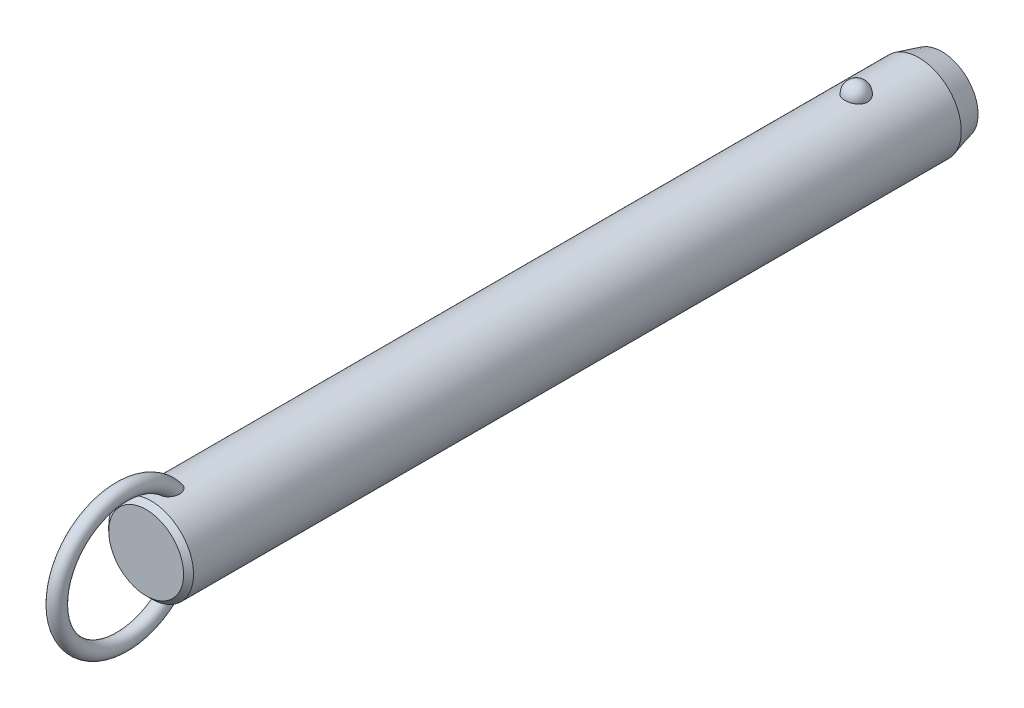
SolidWorks part; units mm, degrees
ref_plane "Front Plane" through (0, 0, 0) normal (0, 0, 1) x (1, 0, 0)
ref_plane "Top Plane" through (0, 0, 0) normal (0, 1, 0) x (1, 0, 0)
ref_plane "Right Plane" through (0, 0, 0) normal (1, 0, 0) x (0, 0, -1)
sketch "Sketch2" plane through (0, 0, 0) normal (0, 0, 1) x (1, 0, 0)
  circle A0 centre (0, 0) radius 11.1
  point P3 (0, 11.1)
  dimension "D1" = 22.2
extrude "Boss-Extrude1" add sketch "Sketch2" along normal blind 170.2
sketch "Sketch3" plane through (0, 0, 0) normal (0, 0, -1) x (-1, 0, 0)
  circle A0 centre (0, 0) radius 11.1
  dimension "D1" = 22.2
extrude "Boss-Extrude2" add sketch "Sketch3" along normal blind 25.4
chamfer "Chamfer1" distance 6 angle 15 1 edges at (-11.1, 0, -25.4)
sketch "Sketch12" plane through (0, 0, 0) normal (1, 0, 0) x (0, 0, -1)
  line L0 (-170.2, 11.1) -> (-170.2, -11.1) construction
  point P0 (-170.2, 0)
sketch "Sketch13" plane through (0, 0, 0) normal (1, 0, 0) x (0, 0, -1)
  circle A0 centre (-189.25, 0) radius 19.05
  point P2 (-170.2, 0)
  dimension "D1" = 38.1
sketch "Sketch14" plane through (0, 0, 0) normal (0, 1, 0) x (1, 0, 0)
  circle A0 centre (0, -172.2) radius 2
  point P2 (0, -170.2)
  dimension "D1" = 4
sweep "Sweep1" add profiles "Sketch14" path "Sketch13"
sketch "Sketch15" plane through (0, 0, 170.2) normal (0, 0, 1) x (1, 0, 0)
  circle A0 centre (0, 0) radius 11.1
  dimension "D1" = 22.2
extrude "Boss-Extrude3" add sketch "Sketch15" along normal blind 12.7
chamfer "Chamfer2" distance 1.3 angle 45 1 edges at (11.1, 0, 182.9)
sketch "Sketch18" plane through (0, 0, 0) normal (1, 0, 0) x (0, 0, -1)
  line L0 (19.4, 11.1) -> (-173.768, 11.1) construction
  line L1 (3, 14.1) -> (3, 8.1)
  line L2 (-173.768, -11.1) -> (19.4, -11.1) construction
  arc A0 (3, 14.1) -> (3, 8.1) centre (3, 11.1) ccw
  point P4 (0, 11.1)
  dimension "D1" = 25.2
revolve "Revolve1" add sketch "Sketch18" angle 360 about L1
